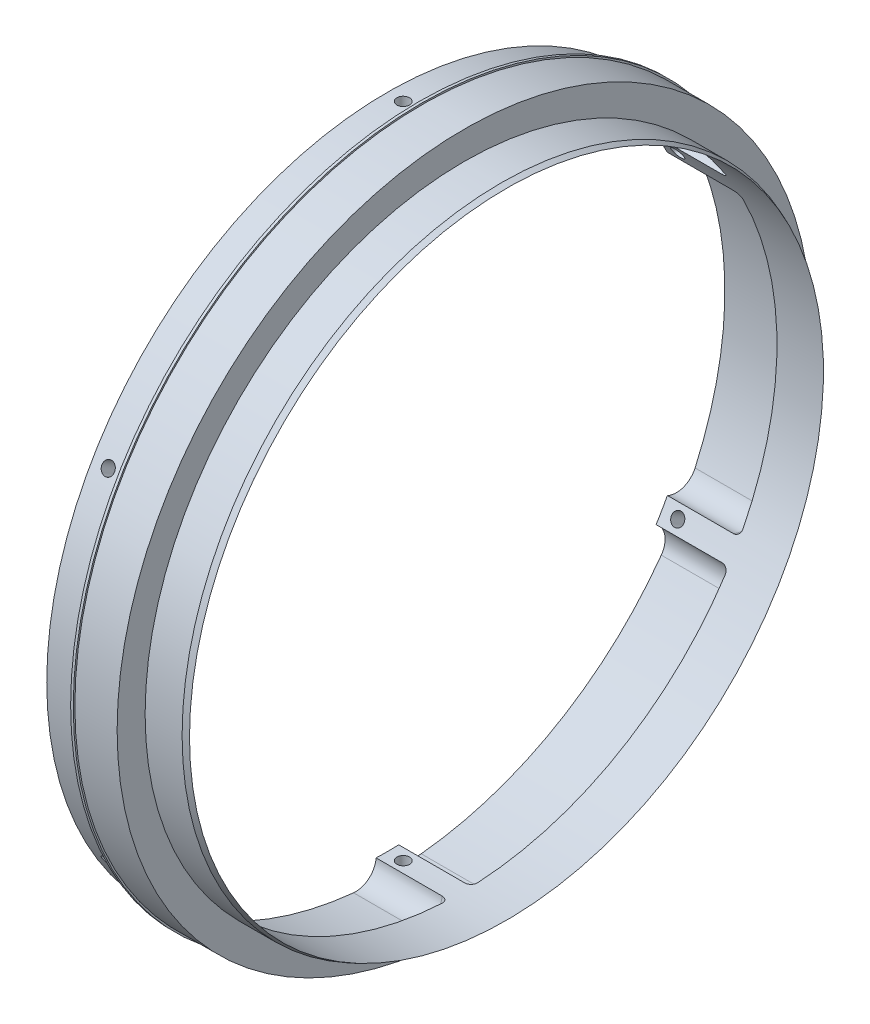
SolidWorks part; units mm, degrees
ref_plane "Front" through (0, 0, 0) normal (0, 0, 1) x (1, 0, 0)
ref_plane "Top" through (0, 0, 0) normal (0, 1, 0) x (1, 0, 0)
ref_plane "Right" through (0, 0, 0) normal (1, 0, 0) x (0, 0, -1)
sketch "Sketch1" plane through (0, 0, 0) normal (0, 0, 1) x (1, 0, 0)
  line L0 (-10.16, 0.508) -> (-1.27, 0.508)
  line L1 (-20.955, 7.62) -> (-20.32, 7.62)
  line L2 (-10.16, 7.239) -> (-10.16, 0.508)
  line L3 (0, 0) -> (-28.6258, 0)
  line L4 (-1.27, 0.508) -> (0, 0)
  line L5 (-28.6258, 5.6896) -> (-28.6258, 0)
  line L6 (-20.955, 7.62) -> (-20.955, 5.6896)
  line L7 (-20.955, 5.6896) -> (-28.6258, 5.6896)
  line L8 (-44.3099, -76.2) -> (29.4033, -76.2) construction
  line L9 (-20.32, 7.62) -> (-20.32, 7.239)
  line L10 (-20.32, 7.239) -> (-10.16, 7.239)
  dimension "D1" = 7.6708
  dimension "D2" = 0.508
  dimension "D3" = 0.635
  dimension "D4" = 10.16
  dimension "D5" = 76.2
  dimension "D6" = 5.6896
  dimension "D7" = 6.731
  dimension "D8" = 0.381
  dimension "D9" = 10.16
  dimension "D10" = 1.27
revolve "Revolve2" add sketch "Sketch1" angle 360 about L8
ref_point "Point1"
ref_plane "Plane1" through (0, -76.2, 0) normal (0, 1, 0) x (1, 0, 0)
ref_plane "Plane2" through (0, -158.0896, 0) normal (0, -1, 0) x (-1, 0, 0)
hole_wizard "#31 (0.12) Diameter Hole1" positions "3DSketch1" profile "Sketch11" hole size "#31" standard "ANSI Inch"
sketch3d "3DSketch1"
  point P0 (-24.8158, -158.0896, 0)
  dimension "D1" = 3.81
sketch "Sketch11" plane through (-24.8158, -158.0896, 0) normal (1, 0, 0) x (0, 0, -1)
  line L0 (0, 0) -> (0, 185.9821)
  line L1 (0, 185.9821) -> (1.524, 185.9821)
  line L2 (1.524, 185.9821) -> (1.524, 0)
  line L5 (1.524, 0) -> (0, 0)
  line L11 (0, -6.35) -> (0, 107.95) construction
  dimension "Thru Hole Dia." = 3.048
  dimension "Thru Hole Depth" = 185.9821
pattern_circular "CirPattern4" count 6 over 360 about axis through (-44.3099, -76.2, 0) along (-1, 0, 0) of "#31 (0.12) Diameter Hole1"
sketch "Sketch8" plane through (-28.6258, 0, 0) normal (-1, 0, 0) x (0, 0, 1)
  line L0 (-7.6343, -152.0166) -> (0, -76.2) construction
  line L1 (0, -76.2) -> (0, -152.4) construction
  line L2 (-61.8419, -120.7198) -> (0, -76.2) construction
  line L3 (0, -76.2) -> (-65.9911, -114.3) construction
  circle A0 centre (0, -76.2) radius 76.2 construction
  arc A1 (-65.841, -123.5988) -> (-8.128, -156.9194) centre (0, -76.2) ccw
  circle A2 centre (0, -76.2) radius 81.8896 construction
  circle A3 centre (0, -76.2) radius 76.2
  arc A4 (-64.5901, -116.6297) -> (-2.7181, -152.3515) centre (0, -76.2) ccw
  circle A5 centre (0, -76.2) radius 81.8896
  circle A6 centre (-61.8419, -120.7198) radius 4.9276
  circle A7 centre (-7.6343, -152.0166) radius 4.9276
  arc A8 (-1.524, -158.0754) -> (1.524, -158.0754) centre (0, -76.2) ccw construction
  arc A9 (-1.524, -152.3848) -> (1.524, -152.3848) centre (0, -76.2) ccw construction
  arc A10 (-1.524, -158.0754) -> (1.524, -158.0754) centre (0, -76.2) ccw
  arc A11 (-1.524, -152.3848) -> (1.524, -152.3848) centre (0, -76.2) ccw
  arc A12 (-64.5901, -116.6297) -> (-2.7181, -152.3515) centre (0, -76.2) ccw
  arc A13 (-66.7399, -112.9726) -> (-65.2159, -115.6122) centre (0, -76.2) ccw construction
  arc A14 (-66.7399, -112.9726) -> (-65.2159, -115.6122) centre (0, -76.2) ccw
  arc A15 (-71.6682, -115.8179) -> (-70.1442, -118.4575) centre (0, -76.2) ccw construction
  arc A16 (-71.6682, -115.8179) -> (-70.1442, -118.4575) centre (0, -76.2) ccw
  point P3 (0, -152.4)
  point P14 (-8.128, -156.9194)
  point P16 (-65.841, -123.5988)
  point P20 (-65.9911, -114.3)
  dimension "D2" = 5.75
  dimension "D3" = 0.762
  dimension "D4" = 5.75
  dimension "D1" = 0
extrude "Cut-Extrude1" cut sketch "Sketch8" against normal blind 17.4498
fillet "Fillet1" radius 1.5875 3 edges at (-11.176, -155.7816, -4.4553) (-11.176, -146.4586, -40.5638) (-11.176, -119.8492, -66.692)
pattern_circular "CirPattern3" count 6 over 360 about axis through (0, -76.2, 0) along (1, 0, 0) of "Cut-Extrude1", "Fillet1"
sketch3d "3DSketch2"
  circle A0 centre (-24.9799, -157.9493, -0.0042) radius 2.0193
  point P2 (-24.9799, -155.93, -0.0042)
  dimension "D1" = 4.0386
